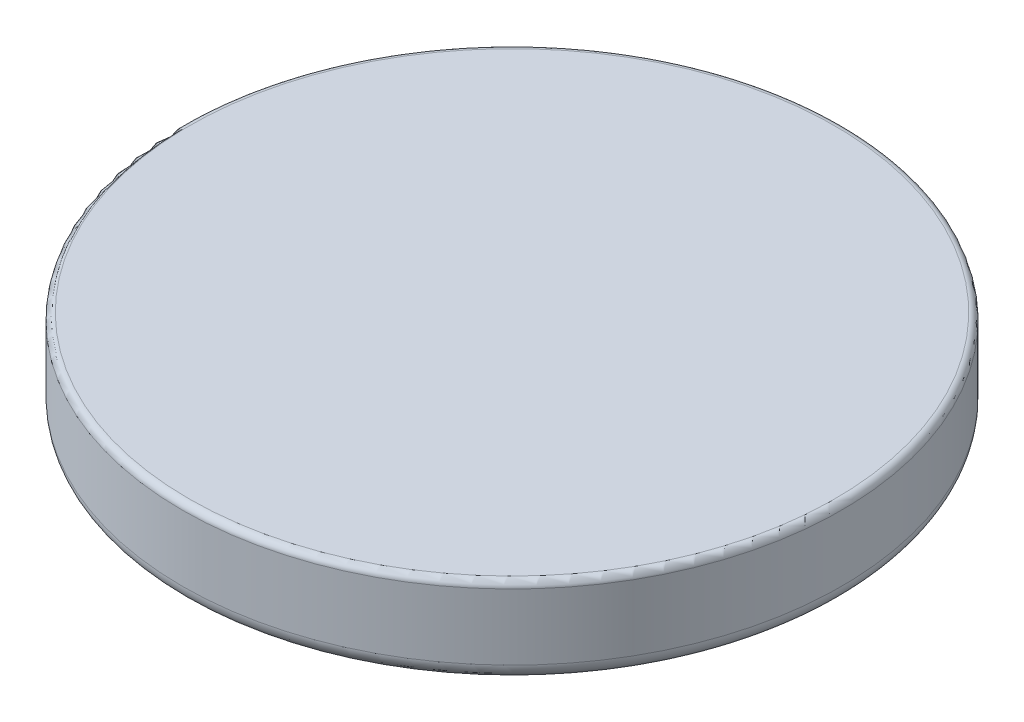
SolidWorks part; units mm, degrees
ref_plane "Plan de face" through (0, 0, 0) normal (0, 0, 1) x (1, 0, 0)
ref_plane "Plan de dessus" through (0, 0, 0) normal (0, 1, 0) x (1, 0, 0)
ref_plane "Plan de droite" through (0, 0, 0) normal (1, 0, 0) x (0, 0, -1)
sketch "Esquisse1" plane through (0, 0, 0) normal (0, 1, 0) x (1, 0, 0)
  circle A0 centre (0, 0) radius 10
extrude "Boss.-Extru.1" add sketch "Esquisse1" along normal blind 3.1
sketch "Esquisse2" plane through (0, 0, 0) normal (0, -1, 0) x (1, 0, 0)
  circle A0 centre (0, 0) radius 9
  circle A1 centre (0, 0) radius 10.1352
extrude "Enlèv. mat.-Extru.1" cut sketch "Esquisse2" against normal blind 0.4
fillet "Congé1" radius 0.2 2 edges at (0, 0, -9) (0, 3.1, 10)
fillet "Congé2" radius 0.5 1 edges at (0, 0.4, -10)
